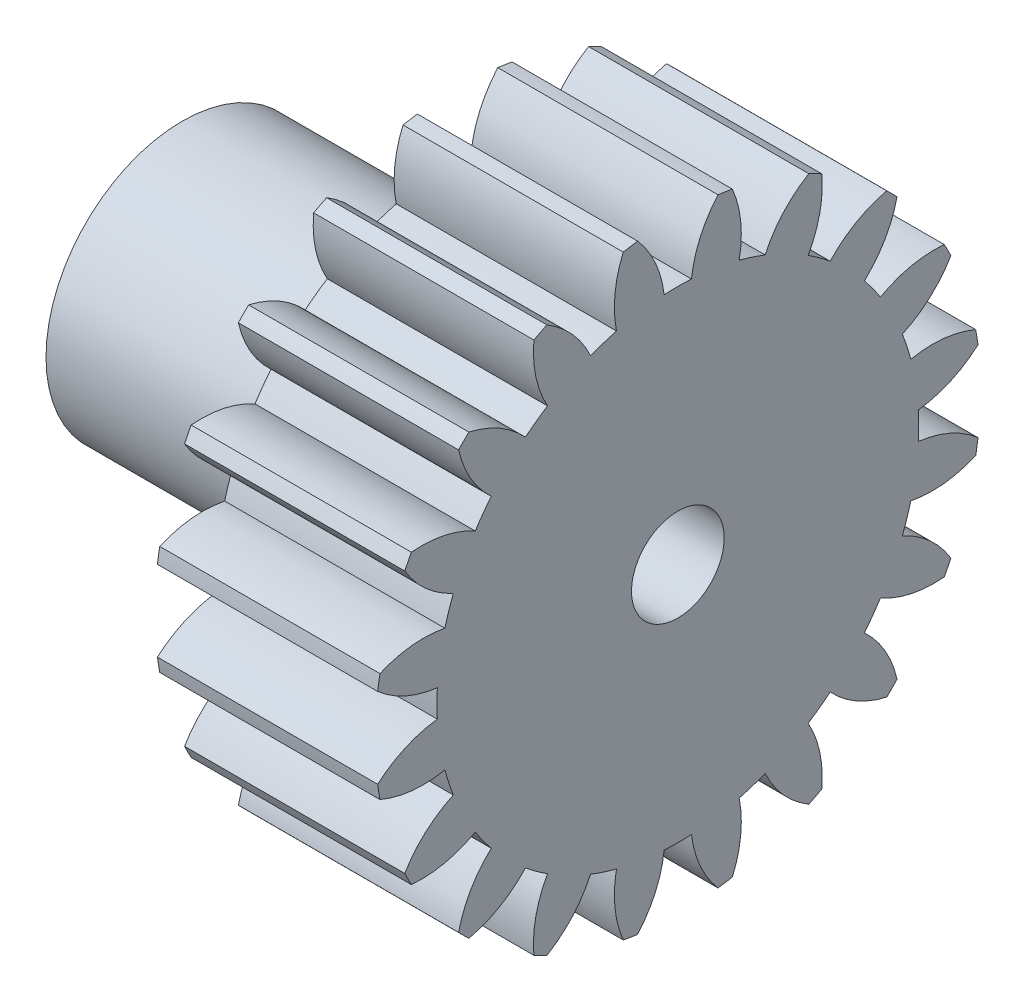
SolidWorks part; units mm, degrees
ref_plane "Plane1" through (0, 0, 0) normal (0, 0, 1) x (1, 0, 0)
ref_plane "Plane2" through (0, 0, 0) normal (0, 1, 0) x (1, 0, 0)
ref_plane "Plane3" through (0, 0, 0) normal (1, 0, 0) x (0, 0, -1)
other "Configuration Table"
sketch "HoldingSke" plane through (0, 0, 0) normal (0, 1, 0) x (1, 0, 0)
  line L0 (0, 0) -> (0.3759, -0.1368)
  line L1 (-15, 0) -> (100, 0) construction
  line L2 (0, 0) -> (-2.1039, 2.3779)
  line L3 (0, 0) -> (-11.863, 4.5341)
  line L4 (0, 0) -> (8.1152, 2.9537)
  line L5 (0, 0) -> (-14.0543, -5.2418)
  line L6 (0, 0) -> (-16.5793, -11.1861)
  line L7 (-2.1039, 2.3779) -> (2.2011, 21.9091)
  line L8 (-76.2, 54.61) -> (-74.4, 54.61)
  line L9 (-71.009, 38.7566) -> (-53.1078, 45.2721)
  line L10 (-76.2, 71.12) -> (104.1128, 71.12)
  line L11 (0, 0) -> (-20, 0)
  line L12 (-76.2, 101.6) -> (-76.113, 101.6)
  line L13 (24.9733, 27.94) -> (52.9518, 28.4284)
  line L14 (24.9733, 27.94) -> (24.9743, 27.94)
  line L15 (24.9733, 27.94) -> (100.4006, 29.5858)
  line L16 (-63.627, -2.5) -> (-12.827, -2.5)
  circle A0 centre (0, 0) radius 5
  circle A1 centre (0, 0) radius 10
  circle A2 centre (0, 0) radius 10
  circle A3 centre (0, 0) radius 5
sketch "BasProSke" plane through (0, 0, 0) normal (0, 1, 0) x (1, 0, 0)
  line L0 (-10, 0) -> (60, 0) construction
  line L1 (0, 0) -> (0, 27.5)
  line L2 (0, 0) -> (20, 0)
  line L3 (20, 0) -> (20, 27.5)
  line L4 (20, 27.5) -> (0, 27.5)
revolve "Base-Revolve" add sketch "BasProSke" angle 360 about L0
sketch "TooCutSke" plane through (0, 0, 0) normal (1, 0, 0) x (0, 0, -1)
  line L1 (0, 0) -> (0, 107) construction
  line L2 (0, 0) -> (-2.1137, 24.9105) construction
  line L3 (0, 0) -> (-7.8012, 49.2549) construction
  line L4 (-2.1137, 24.9105) -> (-3.9006, 24.6275) construction
  arc A0 (1.2377, 21.839) -> (-1.2377, 21.839) centre (0, 0) ccw
  arc A1 (3.6672, 27.28) -> (-3.6672, 27.28) centre (0, 0) ccw
  circle A2 centre (0, 0) radius 25 construction
  circle A3 centre (0, 0) radius 23.4923 construction
  arc A4 (-1.2377, 21.839) -> (-3.6672, 27.28) centre (-11.1689, 20.6675) ccw
  arc A5 (3.6672, 27.28) -> (1.2377, 21.839) centre (11.1689, 20.6675) ccw
extrude "ToothCut" cut sketch "TooCutSke" along normal through all
fillet "Breaks" [suppressed] radius 0.05
fillet "RootFillets" [suppressed] radius 0.626
pattern_circular "TeethCuts" count 20 every 18 about axis through (-10, 0, 0) along (1, 0, 0) of "ToothCut", "RootFillets", "Breaks"
scale "Scale1" scale about centroid uniform scaling yes scale factor 0.6
sketch "Sketch1" plane through (0, 0, 0) normal (1, 0, 0) x (0, 0, -1)
  line L0 (-2.01, 1.5282) -> (2.01, 1.5282)
  arc A0 (-2.01, 1.5282) -> (2.01, 1.5282) centre (0, 0) ccw
  dimension "D1" = 5.05
  dimension "D2" = 4.02
extrude "Cut-Extrude1" cut sketch "Sketch1" along normal through all
sketch "HubNeaOneSke" plane through (4, 0, 0) normal (-1, 0, 0) x (0, 0, 1)
  circle A0 centre (0, 0) radius 10
extrude "HubNearOne" [suppressed] add sketch "HubNeaOneSke" along normal blind 3.0001
sketch "HubNeaBotSke" plane through (4, 0, 0) normal (-1, 0, 0) x (0, 0, 1)
  circle A0 centre (0, 0) radius 10
extrude "HubNearBoth" [suppressed] add sketch "HubNeaBotSke" along normal blind 1.5
ref_plane "FarPln" through (20, 0, 0) normal (1, 0, 0) x (0, 0, -1)
sketch "HubFarSke" plane through (20, 0, 0) normal (1, 0, 0) x (0, 0, -1)
  circle A0 centre (0, 0) radius 10
extrude "HubFar" [suppressed] add sketch "HubFarSke" along normal blind 1.5
sketch "BorSke" plane through (0, 0, 0) normal (1, 0, 0) x (0, 0, -1)
  circle A0 centre (0, 0) radius 5
extrude "Bore" [suppressed] cut sketch "BorSke" along normal mid plane 40.0001
sketch "KeySke" plane through (0, 0, 0) normal (1, 0, 0) x (0, 0, -1)
  line L0 (-2, 0) -> (-2, 6.8)
  line L1 (-2, 6.8) -> (2, 6.8)
  line L2 (2, 6.8) -> (2, 0)
  line L3 (0, 0) -> (0, 34) construction
  line L4 (-2, 0) -> (2, 0)
extrude "Keyway" [suppressed] cut sketch "KeySke" along normal mid plane 40.0001
pattern_circular "Keyway2" [suppressed] count 2 every 90 about axis through (-10, 0, 0) along (1, 0, 0)
sketch "Sketch2" plane through (16, 0, 0) normal (1, 0, 0) x (0, 0, -1)
  circle A0 centre (0, 0) radius 2.525
  arc A1 (-2.01, 1.5282) -> (2.01, 1.5282) centre (0, 0) ccw construction
extrude "Cut-Extrude2" cut sketch "Sketch2" against normal blind 6
sketch "Sketch3" plane through (4, 0, 0) normal (-1, 0, 0) x (0, 0, 1)
  circle A0 centre (0, 0) radius 7.425
  dimension "D1" = 14.85
extrude "Boss-Extrude1" add sketch "Sketch3" along normal blind 15
sketch "Sketch4" plane through (-11, 0, 0) normal (-1, 0, 0) x (0, 0, 1)
  circle A2 centre (0, 0) radius 5.425
  circle A3 centre (0, 0) radius 5.425
  dimension "D1" = 2
extrude "Cut-Extrude3" cut sketch "Sketch4" against normal blind 14
equation "' \"Module@HoldingSke\" = 6.35"
equation "' \"Num_teeth@HoldingSke\" = 12"
equation "' \"Ap@HoldingSke\" =  20"
equation "' \"Ap@HoldingSke\" = 20"
equation "' \"Width@HoldingSke\" = 0.5 * 25.4"
equation "' \"Hub_dia@HoldingSke\"= 1 * 25.4"
equation "' \"Hub_dia@HoldingSke\" = 1 * 25.4"
equation "' \"Overall_len@HoldingSke\" = 1.0 * 25.4"
equation "' \"Bore@HoldingSke\" = 0.75 * 25.4"
equation "' \"T_dim@HoldingSke\" = 0.1 * 25.4"
equation "' \"Width@KeySke\" = 0.25 * 25.4"
equation "' \"Show_teeth@HoldingSke\" = 13"
equation "' \"Backlash@HoldingSke\" = 0.009 * 25.4"
equation "' \"Addendum_fac@HoldingSke\" = 1.0"
equation "' \"Dedendum_fac@HoldingSke\" = 1.25"
equation "' \"Dedendum_add@HoldingSke\" = 0.00005 * 25.4"
equation "' \"Clearance_fac@HoldingSke\" = 0.25"
equation "\"Pitch@HoldingSke\" = 1 / \"Module@HoldingSke\""
equation "\"Overcut_dia@TooCutSke\" = (\"Num_teeth@HoldingSke\" + 2 * \"Addendum_fac@HoldingSke\") / \"Pitch@HoldingSke\" + 0.002 * 25.4"
equation "\"Pitch_dia@TooCutSke\" = \"Num_teeth@HoldingSke\" / \"Pitch@HoldingSke\""
equation "\"Base_dia@TooCutSke\" = \"Num_teeth@HoldingSke\" / \"Pitch@HoldingSke\" * cos((\"Ap@HoldingSke\"  * 3.14159265 / 180))"
equation "\"Root_dia@TooCutSke\" = (\"Num_teeth@HoldingSke\" + 2) / \"Pitch@HoldingSke\" - 2 * (\"Addendum_fac@HoldingSke\" + \"Dedendum_fac@HoldingSke\") / \"Pitch@HoldingSke\" - \"Dedendum_add@HoldingSke\" * 2"
equation "\"Half_ang@TooCutSke\" = 180 / \"Num_teeth@HoldingSke\""
equation "\"Half_CT@TooCutSke\" = \"Num_teeth@HoldingSke\" / \"Pitch@HoldingSke\" * sin((3.14159265 / 2 / \"Num_teeth@HoldingSke\")) / 2 - 7 * \"Backlash@HoldingSke\" / 4"
equation "\"Flank_rad@TooCutSke\" = \"Num_teeth@HoldingSke\" / \"Pitch@HoldingSke\" / 5"
equation "\"Radius@RootFillets\" = \"Clearance_fac@HoldingSke\" / \"Pitch@HoldingSke\" + \"Dedendum_add@HoldingSke\""
equation "\"Break_rad@Breaks\" = 0.02 / \"Pitch@HoldingSke\""
equation "\"Thickness@HoldingSke\" = \"Width@HoldingSke\""
equation "\"OAL@HoldingSke\" = \"Thickness@HoldingSke\""
equation "\"MHD@HoldingSke\" = (\"Num_teeth@HoldingSke\" + 2) / \"Pitch@HoldingSke\" - 2 * (\"Addendum_fac@HoldingSke\" + \"Dedendum_fac@HoldingSke\")  / \"Pitch@HoldingSke\" - \"Dedendum_add@HoldingSke\" * 2"
equation "\"MBD@HoldingSke\" = (\"Num_teeth@HoldingSke\" + 2) / \"Pitch@HoldingSke\" - 2 * (\"Addendum_fac@HoldingSke\" + \"Dedendum_fac@HoldingSke\")  / \"Pitch@HoldingSke\" - \"Dedendum_add@HoldingSke\" * 2 - 0.002 * 25.4"
equation "\"MHD@HoldingSke\" = ((sgn( \"MHD@HoldingSke\" - \"Hub_dia@HoldingSke\" )-1)*( \"MHD@HoldingSke\" - \"Hub_dia@HoldingSke\" ))/-2+ \"Hub_dia@HoldingSke\""
equation "\"MBD@HoldingSke\" = ((sgn( \"MBD@HoldingSke\" - \"Bore@HoldingSke\" )-1)*( \"MBD@HoldingSke\" - \"Bore@HoldingSke\" ))/-2+ \"Bore@HoldingSke\""
equation "\"OAL@HoldingSke\" = ((sgn( \"OAL@HoldingSke\" - \"Overall_len@HoldingSke\" )+1)*( \"OAL@HoldingSke\" - \"Overall_len@HoldingSke\" ))/2 + \"Overall_len@HoldingSke\" + 0.000002 * 25.4"
equation "\"Num_teeth@TeethCuts\" = int( \"Show_teeth@HoldingSke\" ) + 1"
equation "\"Num_teeth@TeethCuts\" = ((sgn( \"Num_teeth@TeethCuts\" - \"Num_teeth@HoldingSke\" )-1)*( \"Num_teeth@TeethCuts\" - \"Num_teeth@HoldingSke\" ))/-2+ \"Num_teeth@HoldingSke\""
equation "\"Num_teeth@TeethCuts\" = ((sgn( \"Num_teeth@TeethCuts\" - 2.0)+1)*( \"Num_teeth@TeethCuts\" - 2.0))/2 +2.0"
equation "\"Angle@TeethCuts\" = 360.0 / \"Num_teeth@HoldingSke\""
equation "\"Diameter@BasProSke\" = (\"Num_teeth@HoldingSke\" + 2 * \"Addendum_fac@HoldingSke\") / \"Pitch@HoldingSke\""
equation "\"Thickness@BasProSke\"  = \"Thickness@HoldingSke\""
equation "' \"Fillet_rad@BasProSke\" =  \"Thickness@HoldingSke\" * 0.05"
equation "' \"Fillet_rad@BasProSke\" = \"Thickness@HoldingSke\" * 0.05"
equation "\"MHD@HoldingSke\" = ((sgn( \"MHD@HoldingSke\" - \"Root_dia@TooCutSke\" )-1)*( \"MHD@HoldingSke\" - \"Root_dia@TooCutSke\" ))/-2+ \"Root_dia@TooCutSke\""
equation "\"Diameter@HubNeaOneSke\" = \"MHD@HoldingSke\""
equation "\"Length@HubNearOne\" = \"OAL@HoldingSke\" - \"Thickness@BasProSke\""
equation "\"Diameter@HubNeaBotSke\" = \"MHD@HoldingSke\""
equation "\"Length@HubNearBoth\" = ( \"OAL@HoldingSke\" - \"Thickness@BasProSke\" ) / 2.0"
equation "\"Thickness@FarPln\" = \"Thickness@BasProSke\""
equation "\"Diameter@HubFarSke\" = \"MHD@HoldingSke\""
equation "\"Length@HubFar\" = ( \"OAL@HoldingSke\" - \"Thickness@BasProSke\" ) / 2.0"
equation "\"Diameter@BorSke\" = \"MBD@HoldingSke\""
equation "\"D1@Bore\" = \"OAL@HoldingSke\" * 2.0"
equation "\"D1@Keyway\" = \"OAL@HoldingSke\" * 2.0"
equation "\"Offset@KeySke\" = \"T_dim@HoldingSke\" + \"MBD@HoldingSke\" / 2.0"
